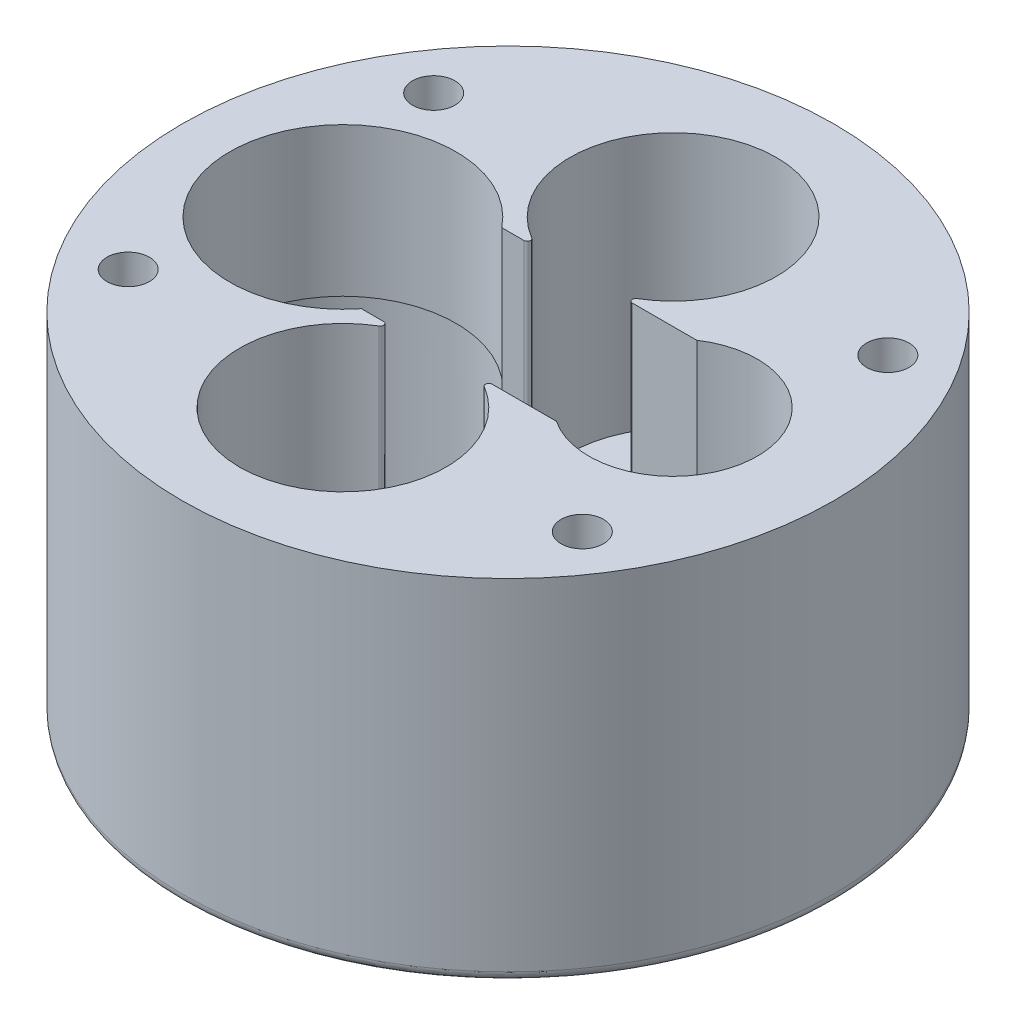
SolidWorks part; units mm, degrees
ref_plane "Front Plane" through (0, 0, 0) normal (0, 0, 1) x (1, 0, 0)
ref_plane "Top Plane" through (0, 0, 0) normal (0, 1, 0) x (1, 0, 0)
ref_plane "Right Plane" through (0, 0, 0) normal (1, 0, 0) x (0, 0, -1)
sketch "Sketch1" plane through (0, 0, 0) normal (0, 1, 0) x (1, 0, 0)
  line L0 (0, 0) -> (25.4, 0) construction
  line L1 (-34.925, 23.495) -> (34.925, 23.495) construction
  line L2 (-34.925, 23.495) -> (-34.925, -23.495) construction
  line L3 (-34.925, -23.495) -> (34.925, -23.495) construction
  line L4 (34.925, 23.495) -> (34.925, -23.495) construction
  line L5 (-34.925, 23.495) -> (34.925, -23.495) construction
  line L6 (-34.925, -23.495) -> (34.925, 23.495) construction
  line L7 (0, 0) -> (-25.4, 0) construction
  line L9 (-10.4339, 10.795) -> (18.2394, 10.795)
  line L11 (-10.4339, -10.795) -> (18.2394, -10.795)
  circle A0 centre (0, 0) radius 50.165
  circle A1 centre (-34.925, 23.495) radius 3.2639
  circle A2 centre (34.925, 23.495) radius 3.2639
  circle A3 centre (34.925, -23.495) radius 3.2639
  circle A4 centre (-34.925, -23.495) radius 3.2639
  arc A5 (-10.4339, 10.795) -> (-10.4339, -10.795) centre (-25.4, 0) ccw
  arc A6 (18.2394, -10.795) -> (18.2394, 10.795) centre (25.4, 0) ccw
  point P20 (0, 0)
  dimension "D1" = 100.33
  dimension "D2" = 6.5278
  dimension "D7" = 25.908
  dimension "D8" = 36.9062
  dimension "D3" = 69.85
  dimension "D4" = 46.99
  dimension "D5" = 25.4
  dimension "D6" = 25.4
  dimension "D9" = 21.59
extrude "Boss-Extrude1" add sketch "Sketch1" along normal blind 53.975
sketch "Sketch2" plane through (0, 53.975, 0) normal (0, -1, 0) x (1, 0, 0)
  line L0 (0, 25.4) -> (0, -25.4) construction
  circle A0 centre (0, 25.4) radius 15.875
  circle A1 centre (0, -25.4) radius 15.875
  point P4 (0, 0)
  dimension "D2" = 31.75
  dimension "D3" = 31.75
  dimension "D1" = 50.8
extrude "Cut-Extrude1" cut sketch "Sketch2" along normal blind 39.37
sketch "Sketch3" plane through (0, 14.605, 0) normal (0, 1, 0) x (1, 0, 0)
  line L0 (0, 0) -> (0, -25.4) construction
  line L1 (3.175, 0) -> (3.175, -25.4)
  line L2 (-3.175, 0) -> (-3.175, -25.4)
  circle A0 centre (0, 25.4) radius 7.3406
  arc A2 (3.175, 0) -> (-3.175, 0) centre (0, 0) ccw
  arc A3 (-3.175, -25.4) -> (3.175, -25.4) centre (0, -25.4) ccw
  arc A4 (-6.2217, -10.795) -> (6.2217, -10.795) centre (0, -25.4) ccw construction
  point P6 (0, -12.7)
  dimension "D1" = 14.6812
  dimension "D2" = 6.35
extrude "Cut-Extrude2" cut sketch "Sketch3" against normal through all
sketch "Sketch4" plane through (0, 0, 0) normal (0, -1, 0) x (1, 0, 0)
  line L0 (-10.4339, 10.795) -> (-3.175, 10.795) construction
  line L1 (21.4144, 7.62) -> (21.4144, -7.62)
  line L2 (18.2394, -10.795) -> (-10.4339, -10.795) construction
  arc A0 (18.2394, -10.795) -> (18.2394, 10.795) centre (25.4, 0) ccw construction
  arc A1 (18.2394, -10.795) -> (18.2394, 10.795) centre (25.4, 0) ccw
  circle A2 centre (25.4, 0) radius 1.7272
  arc A3 (21.4144, 7.62) -> (18.2394, 10.795) centre (18.2394, 7.62) ccw
  arc A4 (18.2394, -10.795) -> (21.4144, -7.62) centre (18.2394, -7.62) ccw
  point P4 (18.2394, 0)
  dimension "D1" = 3.4544
  dimension "D2" = 3.175
extrude "Boss-Extrude2" add sketch "Sketch4" against normal blind 6.35
sketch "Sketch5" plane through (0, 0, 0) normal (0, -1, 0) x (1, 0, 0)
  circle A0 centre (-34.925, -23.495) radius 5.5562
  circle A1 centre (-34.925, 23.495) radius 5.5562
  circle A2 centre (34.925, 23.495) radius 5.5562
  circle A3 centre (34.925, -23.495) radius 5.5562
  dimension "D1" = 11.1125
extrude "Cut-Extrude3" cut sketch "Sketch5" against normal blind 12.7
fillet "Fillet1" radius 0.508 4 edges at (6.2217, 34.29, -10.795) (-6.2217, 34.29, -10.795) (6.2217, 34.29, 10.795) (-6.2217, 34.29, 10.795)
fillet "Fillet2" radius 1.5875 18 edges at (0, 0, 50.165) (10.7072, 0, 10.795) (-6.8044, 0, 10.795) (20.4845, 0, 9.8651) (21.4144, 0, 0) (20.4845, 0, -9.8651) (0, 0, -18.0594) (3.9028, 0, -10.795) (-3.175, 0, 18.0975) (0, 0, 28.575) (-3.175, 7.3025, 10.795) (3.175, 7.3025, 10.795) (3.175, 0, 18.0975) (0, 14.605, -18.0594) (34.925, 0, -29.0512) (34.925, 0, 17.9388) (-34.925, 0, 17.9388) (-34.925, 0, -29.0512)
sketch "Sketch6" plane through (0, 53.975, 0) normal (0, 1, 0) x (1, 0, 0)
  line L0 (-10.4339, 10.795) -> (-11.7547, 10.795)
  line L1 (-10.4339, -10.795) -> (-11.7547, -10.795)
  arc A0 (-10.4339, 10.795) -> (-10.4339, -10.795) centre (-25.4, 0) ccw construction
  arc A1 (-10.4339, 10.795) -> (-10.4339, -10.795) centre (-25.4, 0) ccw
  arc A2 (-11.7547, 10.795) -> (-11.7547, -10.795) centre (-25.4, 0) ccw
  dimension "D1" = 34.798
extrude "Boss-Extrude3" add sketch "Sketch6" against normal blind 22.86
